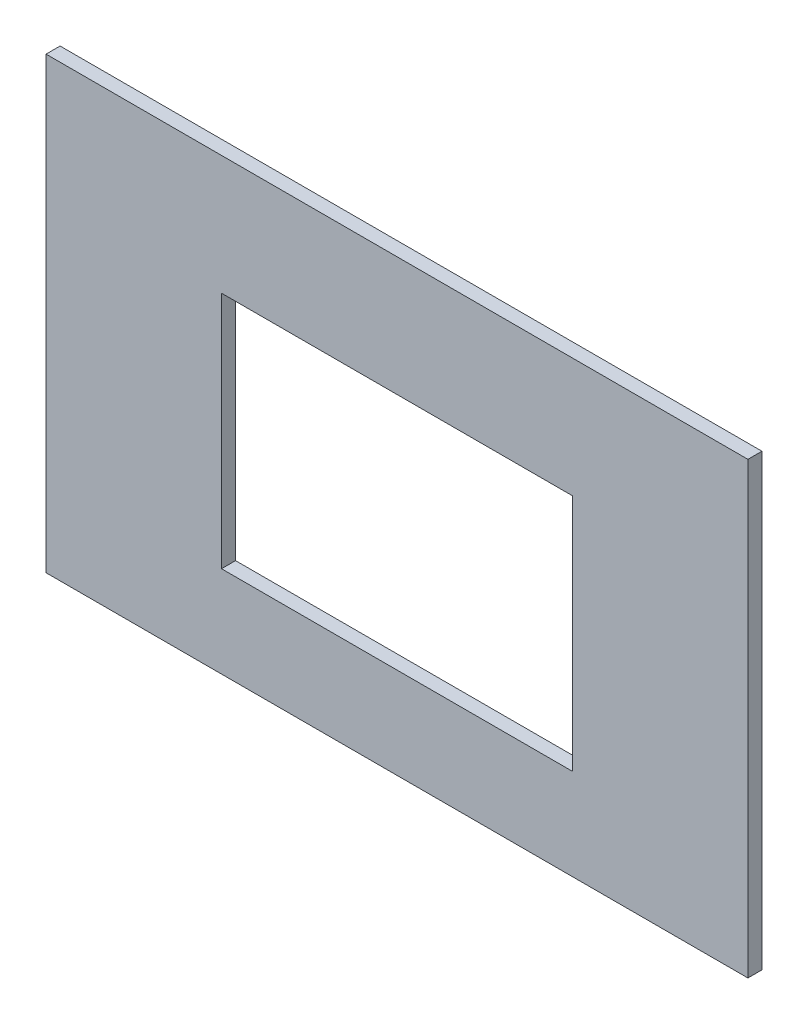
SolidWorks part; units mm, degrees
ref_plane "Front Plane" through (0, 0, 0) normal (0, 0, 1) x (1, 0, 0)
ref_plane "Top Plane" through (0, 0, 0) normal (0, 1, 0) x (1, 0, 0)
ref_plane "Right Plane" through (0, 0, 0) normal (1, 0, 0) x (0, 0, -1)
sketch "Sketch1" plane through (0, 0, 0) normal (0, 0, 1) x (1, 0, 0)
  line L1 (0, 0) -> (317.5, 0)
  line L2 (0, 0) -> (0, 203.2)
  line L3 (0, 203.2) -> (317.5, 203.2)
  line L4 (317.5, 0) -> (317.5, 203.2)
  dimension "D1" = 317.5
  dimension "D2" = 203.2
extrude "Boss-Extrude1" add sketch "Sketch1" along normal blind 6.35
sketch "Sketch2" plane through (0, 0, 6.35) normal (0, 0, 1) x (1, 0, 0)
  line L0 (0, 203.2) -> (0, 0) construction
  line L1 (79.375, 41.275) -> (238.125, 41.275)
  line L2 (79.375, 41.275) -> (79.375, 149.225)
  line L3 (79.375, 149.225) -> (238.125, 149.225)
  line L4 (238.125, 41.275) -> (238.125, 149.225)
  line L5 (317.5, 203.2) -> (0, 203.2) construction
  dimension "D1" = 107.95
  dimension "D2" = 158.75
  dimension "D3" = 79.375
  dimension "D4" = 53.975
extrude "Cut-Extrude1" cut sketch "Sketch2" against normal blind 6.35 contours L3 L4 L1 L2
